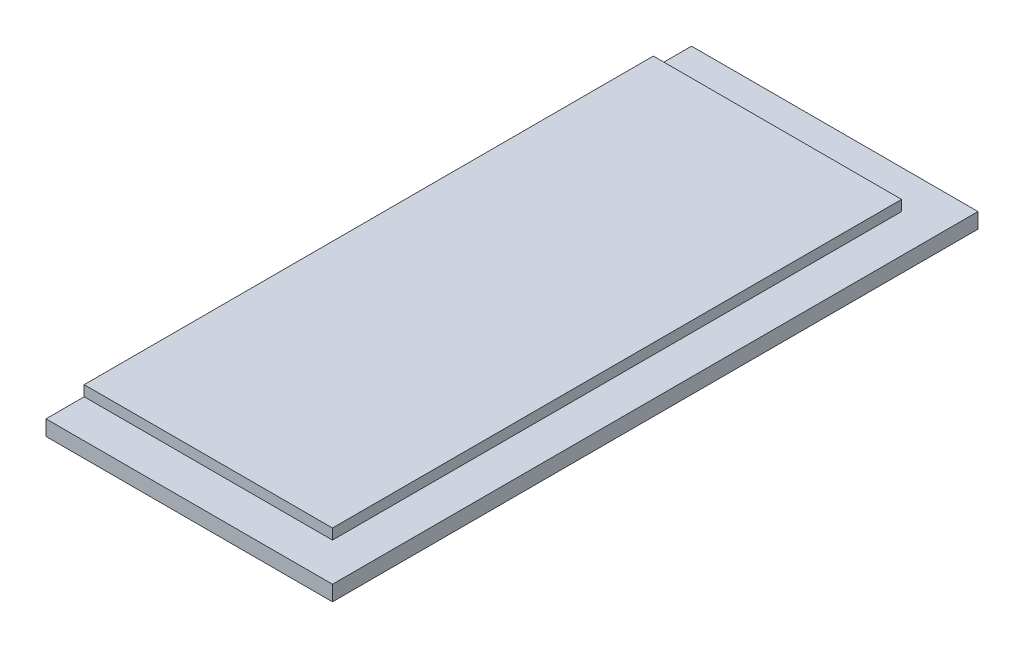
SolidWorks part; units mm, degrees
ref_plane "Front Plane" through (0, 0, 0) normal (0, 0, 1) x (1, 0, 0)
ref_plane "Top Plane" through (0, 0, 0) normal (0, 1, 0) x (1, 0, 0)
ref_plane "Right Plane" through (0, 0, 0) normal (1, 0, 0) x (0, 0, -1)
sketch "Sketch1" plane through (0, 0, 0) normal (0, 1, 0) x (1, 0, 0)
  line L1 (-15, -33.8) -> (15, -33.8)
  line L2 (-15, -33.8) -> (-15, 33.8)
  line L3 (-15, 33.8) -> (15, 33.8)
  line L4 (15, -33.8) -> (15, 33.8)
  line L5 (-15, -33.8) -> (15, 33.8) construction
  line L6 (-15, 33.8) -> (15, -33.8) construction
  point P0 (0, 0)
  dimension "D1" = 30
  dimension "D2" = 67.6
extrude "Boss-Extrude1" add sketch "Sketch1" along normal blind 3.8
sketch "Sketch2" plane through (0, 0, 33.8) normal (0, 0, 1) x (1, 0, 0)
  line L0 (15, 1.9) -> (7.1729, 1.9) construction
  line L1 (15, 3.8) -> (11, 3.8)
  line L2 (15, 3.8) -> (15, 2.7)
  line L3 (15, 2.7) -> (11, 2.7)
  line L4 (11, 3.8) -> (11, 2.7)
  line L5 (15, 0) -> (11, 0)
  line L6 (15, 0) -> (15, 1.1)
  line L7 (15, 1.1) -> (11, 1.1)
  line L8 (11, 0) -> (11, 1.1)
  line L9 (15, 3.8) -> (15, 0) construction
  dimension "D1" = 1.6
  dimension "D2" = 4
  dimension "D3" = 4
extrude "Cut-Extrude1" cut sketch "Sketch2" against normal up to next
sketch "Sketch3" plane through (-15, 0, 0) normal (-1, 0, 0) x (0, 0, 1)
  line L0 (33.8, 1.9) -> (29.0366, 1.9) construction
  line L1 (33.8, 3.8) -> (29.8, 3.8)
  line L2 (33.8, 3.8) -> (33.8, 2.7)
  line L3 (33.8, 2.7) -> (29.8, 2.7)
  line L4 (29.8, 3.8) -> (29.8, 2.7)
  line L5 (29.8, 1.1) -> (33.8, 1.1)
  line L6 (29.8, 1.1) -> (29.8, 0)
  line L7 (29.8, 0) -> (33.8, 0)
  line L8 (33.8, 1.1) -> (33.8, 0)
  line L9 (33.8, 3.8) -> (33.8, 0) construction
  line L11 (-33.8, 3.8) -> (-29.8, 3.8)
  line L12 (-33.8, 3.8) -> (-33.8, 2.7)
  line L13 (-33.8, 2.7) -> (-29.8, 2.7)
  line L14 (-29.8, 3.8) -> (-29.8, 2.7)
  line L15 (-33.8, 0) -> (-29.8, 0)
  line L16 (-33.8, 0) -> (-33.8, 1.1)
  line L17 (-33.8, 1.1) -> (-29.8, 1.1)
  line L18 (-29.8, 0) -> (-29.8, 1.1)
  dimension "D1" = 4
  dimension "D2" = 4
  dimension "D3" = 1.6
  dimension "D4" = 1.6
  dimension "D5" = 4
  dimension "D6" = 4
extrude "Cut-Extrude2" cut sketch "Sketch3" against normal up to next
